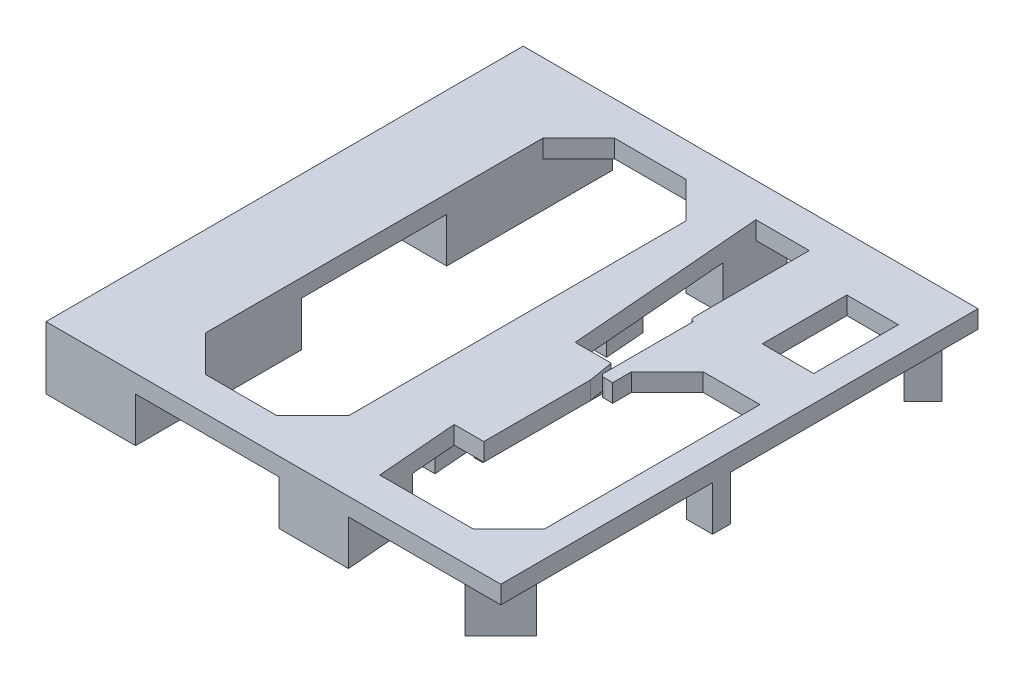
SolidWorks part; units mm, degrees
ref_plane "Front Plane" through (0, 0, 0) normal (0, 0, 1) x (1, 0, 0)
ref_plane "Top Plane" through (0, 0, 0) normal (0, 1, 0) x (1, 0, 0)
ref_plane "Right Plane" through (0, 0, 0) normal (1, 0, 0) x (0, 0, -1)
sketch "Sketch11" plane through (0, 0, 0) normal (0, 1, 0) x (1, 0, 0)
  line L0 (50, -22.85) -> (54, -18.85)
  line L1 (47.65, 5.2) -> (43.65, 1.2)
  line L3 (54, 11.2) -> (48.25, 11.2)
  line L4 (48.25, 20.65) -> (48.25, 11.2)
  line L5 (42.25, 8.3) -> (42.25, 9.5)
  line L6 (43.65, 1.2) -> (43.65, -0.9)
  line L7 (41.85, 9.9) -> (41.85, 22.85)
  line L8 (37.6615, 0.9) -> (41.6826, 0.9)
  line L9 (56.9, -26.65) -> (56.9, 26.65)
  line L10 (42.65, -0.9) -> (43.65, -0.9)
  line L11 (54, 20.65) -> (48.25, 20.65)
  line L12 (54, 11.2) -> (47.65, 11.2) construction
  line L13 (48.25, 8.3) -> (48.25, -0.5) construction
  line L14 (56.9, -18.85) -> (56.9, 5.2) construction
  line L15 (54, 11.2) -> (54, 20.65)
  line L16 (6.1, 26.65) -> (6.1, -26.65)
  line L17 (28.1, -22.85) -> (32.1, -18.85)
  line L18 (54, -18.85) -> (54, 5.2)
  line L19 (16.1, 18.85) -> (16.1, -18.85)
  line L20 (32.1, -18.85) -> (32.1, 18.85)
  line L21 (16.1, -18.85) -> (20.1, -22.85)
  line L22 (41.6826, 0.9) -> (42.15, -1.8733)
  line L23 (20.1, -22.85) -> (28.1, -22.85)
  line L24 (20.1, 22.85) -> (28.1, 22.85)
  line L25 (42.25, 8.3) -> (42.25, -0.5)
  line L26 (20.1, 22.85) -> (16.1, 18.85)
  line L27 (28.1, 22.85) -> (32.1, 18.85)
  line L28 (42.15, -1.8733) -> (42.15, -13.9)
  line L29 (42.15, -13.8) -> (38.8468, -13.8)
  line L30 (39.5765, -22.85) -> (38.8468, -13.8)
  line L31 (50, -22.85) -> (39.5765, -22.85)
  line L32 (41.85, 22.85) -> (35.8916, 22.85)
  line L33 (35.8916, 22.85) -> (37.6615, 0.9)
  line L34 (56.9, -26.65) -> (6.1, -26.65)
  line L36 (6.1, 26.65) -> (56.9, 26.65)
  line L37 (54, 5.2) -> (47.65, 5.2)
  arc A0 (41.85, 9.9) -> (42.25, 9.5) centre (42.25, 9.9) ccw
  arc A1 (42.25, -0.5) -> (42.65, -0.9) centre (42.65, -0.5) ccw
  point P0 (54, -22.85)
  point P9 (32.1, -22.85)
  point P17 (32.1, 22.85)
  point P50 (16.1, -22.85)
  point P55 (16.1, 22.85)
  point P72 (43.65, 5.2)
  dimension "D1" = 2.9
  dimension "D4" = 6
  dimension "D2" = 6
  dimension "D3" = 6
  dimension "D6" = 0
  dimension "D7" = 0
sketch "Sketch12" plane through (0, 0, 0) normal (0, 1, 0) x (1, 0, 0)
  line L1 (54, -1) -> (54, -3)
  line L2 (33.8673, 8.2) -> (33.5085, 12.65)
  line L4 (16.1, 26.65) -> (6.1, 26.65)
  line L5 (56.9, -1) -> (56.9, -3)
  line L6 (32.1, -8.2) -> (35.1897, -8.2)
  line L7 (16.1, -26.65) -> (6.1, -26.65)
  line L8 (32.1, 8.2) -> (33.8673, 8.2)
  line L9 (32.1, -8.2) -> (32.1, -12.65)
  line L10 (56.9, 22.65) -> (52.9, 26.65)
  line L11 (54, -3) -> (56.9, -3)
  line L12 (56.9, -1) -> (54, -1)
  line L13 (56.9, -22.65) -> (52.9, -26.65)
  line L14 (54.7787, -20.5287) -> (50.7787, -24.5287)
  line L15 (54.7787, 20.5287) -> (50.7787, 24.5287)
  line L16 (54.7787, 20.5287) -> (56.9, 22.65)
  line L17 (50.7787, 24.5287) -> (52.9, 26.65)
  line L18 (56.9, -22.65) -> (54.7787, -20.5287)
  line L19 (50.7787, -24.5287) -> (52.9, -26.65)
  line L20 (16.1, -8.1) -> (6.1, -8.1)
  line L22 (6.1, -8.1) -> (6.1, -26.65)
  line L23 (16.1, -8.1) -> (16.1, -26.65)
  line L24 (16.1, 8.1) -> (16.1, 26.65)
  line L25 (6.1, 8.1) -> (6.1, 26.65)
  line L26 (16.1, 26.65) -> (16.1, -26.65) construction
  line L27 (32.1, 26.65) -> (35.5852, 26.65)
  line L28 (36.2141, 18.85) -> (35.5852, 26.65)
  line L29 (32.1, 18.85) -> (36.2141, 18.85)
  line L30 (32.1, 26.65) -> (32.1, 18.85)
  line L31 (35.5485, -12.65) -> (35.1897, -8.2)
  line L32 (33.5085, 12.65) -> (32.1, 12.65)
  line L33 (32.1, 12.65) -> (32.1, 8.2)
  line L34 (32.1, -12.65) -> (35.5485, -12.65)
  line L35 (39.254, -18.85) -> (32.1, -18.85)
  line L36 (32.1, -18.85) -> (32.1, -26.65)
  line L37 (32.1, -26.65) -> (39.8829, -26.65)
  line L38 (39.254, -18.85) -> (39.8829, -26.65)
  line L39 (16.1, 8.1) -> (6.1, 8.1)
  line L40 (6.1, 26.65) -> (6.1, -26.65) construction
  point P9 (56.9, 26.65)
  point P11 (56.9, -26.65)
  dimension "D3" = 16
  dimension "D4" = 16
  dimension "D1" = 3
  dimension "D2" = 3
sketch "Sketch13" plane through (0, 0, 0) normal (0, 1, 0) x (1, 0, 0)
  line L1 (43.25, 13.5) -> (42.25, 13.5)
  line L2 (43.25, 13.5) -> (43.25, -0.5)
  line L3 (43.25, -0.5) -> (42.25, -0.5)
  line L4 (42.25, 13.5) -> (42.25, -0.5)
  line L5 (40.75, 0.5) -> (41.75, 0.5)
  line L6 (40.75, 0.5) -> (40.75, -13.5)
  line L7 (40.75, -13.5) -> (41.75, -13.5)
  line L8 (41.75, 0.5) -> (41.75, -13.5)
extrude "Boss-Extrude1" add sketch "Sketch11" along normal blind 2
extrude "Boss-Extrude2" add sketch "Sketch12" against normal blind 5
extrude "Boss-Extrude3" add sketch "Sketch13" against normal blind 0.4
